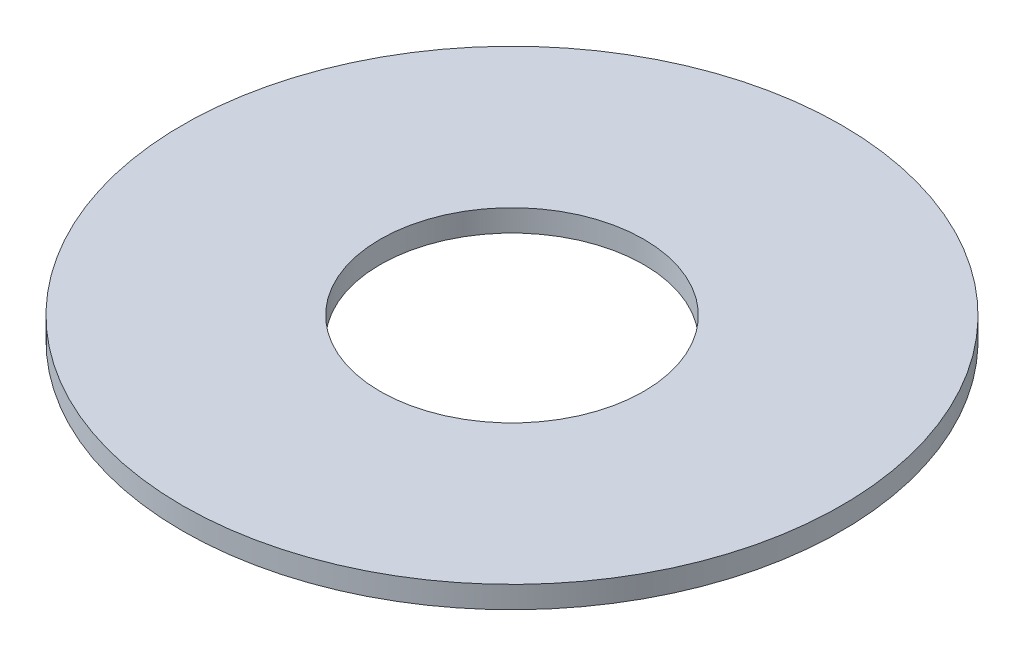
SolidWorks part; units mm, degrees
ref_plane "Front Plane" through (0, 0, 0) normal (0, 0, 1) x (1, 0, 0)
ref_plane "Top Plane" through (0, 0, 0) normal (0, 1, 0) x (1, 0, 0)
ref_plane "Right Plane" through (0, 0, 0) normal (1, 0, 0) x (0, 0, -1)
sketch "Sketch1" plane through (0, 0, 0) normal (0, 1, 0) x (1, 0, 0)
  circle A0 centre (0, 0) radius 7.5
  circle A1 centre (0, 0) radius 3
extrude "Boss-Extrude1" add sketch "Sketch1" along normal blind 0.5
